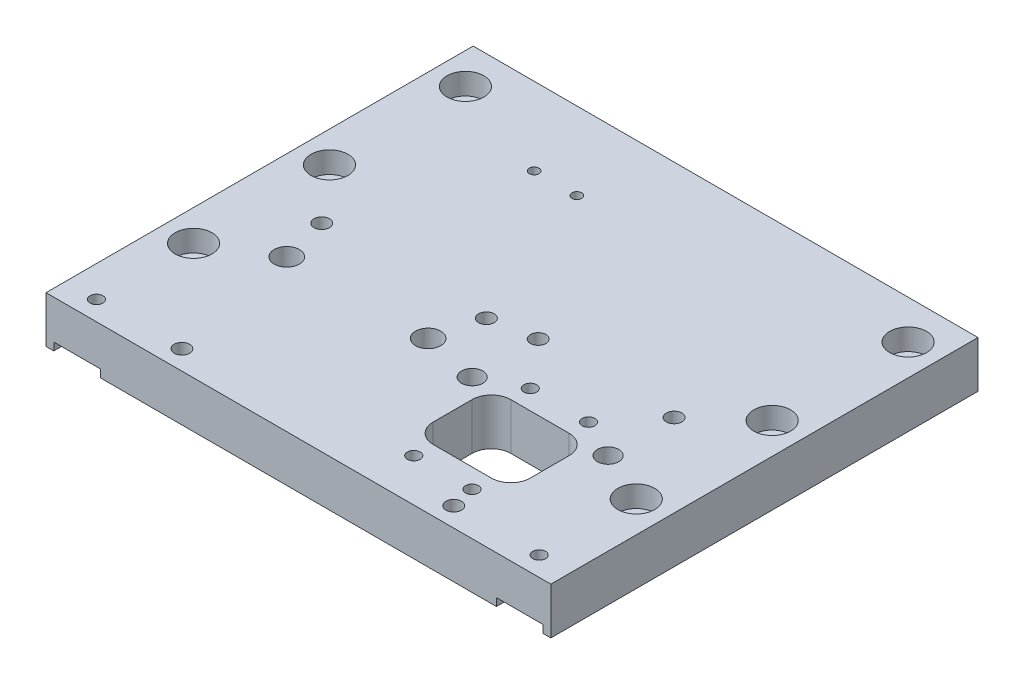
SolidWorks part; units mm, degrees
ref_plane "前视基准面" through (0, 0, 0) normal (0, 0, 1) x (1, 0, 0)
ref_plane "上视基准面" through (0, 0, 0) normal (0, 1, 0) x (1, 0, 0)
ref_plane "右视基准面" through (0, 0, 0) normal (1, 0, 0) x (0, 0, -1)
sketch "草图1" plane through (0, 0, 0) normal (0, 0, 1) x (1, 0, 0)
  line L0 (0, 12) -> (130, 12)
  line L1 (0, 0) -> (2, 0)
  line L2 (0, 0) -> (0, 12)
  line L3 (130, 0) -> (130, 12)
  line L4 (2, 2) -> (2, 0)
  line L5 (14, 2) -> (14, 0)
  line L6 (116, 2) -> (116, 0)
  line L7 (128, 2) -> (128, 0)
  line L8 (2, 2) -> (14, 2)
  line L9 (116, 2) -> (128, 2)
  line L10 (128, 0) -> (130, 0)
  line L11 (14, 0) -> (116, 0)
extrude "凸台-拉伸1" add sketch "草图1" along normal blind 110
sketch "草图2" plane through (0, 12, 0) normal (0, 1, 0) x (1, 0, 0)
  line L0 (83.7, -94) -> (98.7, -94)
  line L1 (83.7, -74) -> (98.7, -74)
  line L2 (78.7, -89) -> (78.7, -79)
  line L3 (103.7, -89) -> (103.7, -79)
  circle A0 centre (23, -71) radius 3.25
  circle A1 centre (59.4, -71) radius 3.25
  circle A2 centre (20, -59) radius 2
  circle A3 centre (62.4, -59) radius 2
  circle A4 centre (73.7, -73.96) radius 2.75
  circle A5 centre (108.7, -73.96) radius 2.75
  circle A6 centre (108.7, -56.96) radius 2
  circle A7 centre (73.7, -56.96) radius 2
  circle A8 centre (35.7, -20) radius 1.25
  circle A9 centre (46.7, -20) radius 1.25
  circle A10 centre (8, -105) radius 1.65
  circle A11 centre (122, -105) radius 1.65
  circle A12 centre (30, -105) radius 2
  circle A13 centre (100, -105) radius 2
  circle A14 centre (8, -10) radius 2.75
  circle A15 centre (8, -45) radius 2.75
  circle A16 centre (8, -80) radius 2.75
  circle A17 centre (122, -80) radius 2.75
  circle A18 centre (122, -45) radius 2.75
  circle A19 centre (122, -10) radius 2.75
  arc A20 (83.7, -74) -> (78.7, -79) centre (83.7, -79) ccw
  arc A21 (103.7, -79) -> (98.7, -74) centre (98.7, -79) ccw
  arc A22 (98.7, -94) -> (103.7, -89) centre (98.7, -89) ccw
  arc A23 (78.7, -89) -> (83.7, -94) centre (83.7, -89) ccw
  circle A24 centre (83.7, -69) radius 1.65
  circle A25 centre (98.7, -69) radius 1.65
  circle A26 centre (98.7, -99) radius 1.65
  circle A27 centre (83.7, -99) radius 1.65
extrude "切除-拉伸1" cut sketch "草图2" against normal blind 110
sketch "草图3" plane through (0, 12, 0) normal (0, 1, 0) x (1, 0, 0)
  circle A0 centre (8, -10) radius 4.75
  circle A1 centre (8, -45) radius 4.75
  circle A2 centre (8, -80) radius 4.75
  circle A3 centre (122, -80) radius 4.75
  circle A4 centre (122, -45) radius 4.75
  circle A5 centre (122, -10) radius 4.75
extrude "切除-拉伸2" cut sketch "草图3" against normal blind 5.5
sketch "草图4" plane through (0, 12, 0) normal (0, 1, 0) x (1, 0, 0)
  circle A0 centre (23, -71) radius 5.5 construction
  circle A1 centre (59.4, -71) radius 5.5 construction
  circle A2 centre (73.7, -73.96) radius 4.75 construction
  circle A3 centre (108.7, -73.96) radius 4.75 construction
sketch "草图5" plane through (0, 0, 0) normal (0, -1, 0) x (1, 0, 0)
  circle A0 centre (23, 71) radius 5.5
  circle A1 centre (59.4, 71) radius 5.5
  circle A2 centre (73.7, 73.96) radius 4.75
  circle A3 centre (108.7, 73.96) radius 4.75
extrude "切除-拉伸3" cut sketch "草图5" against normal blind 6.5
